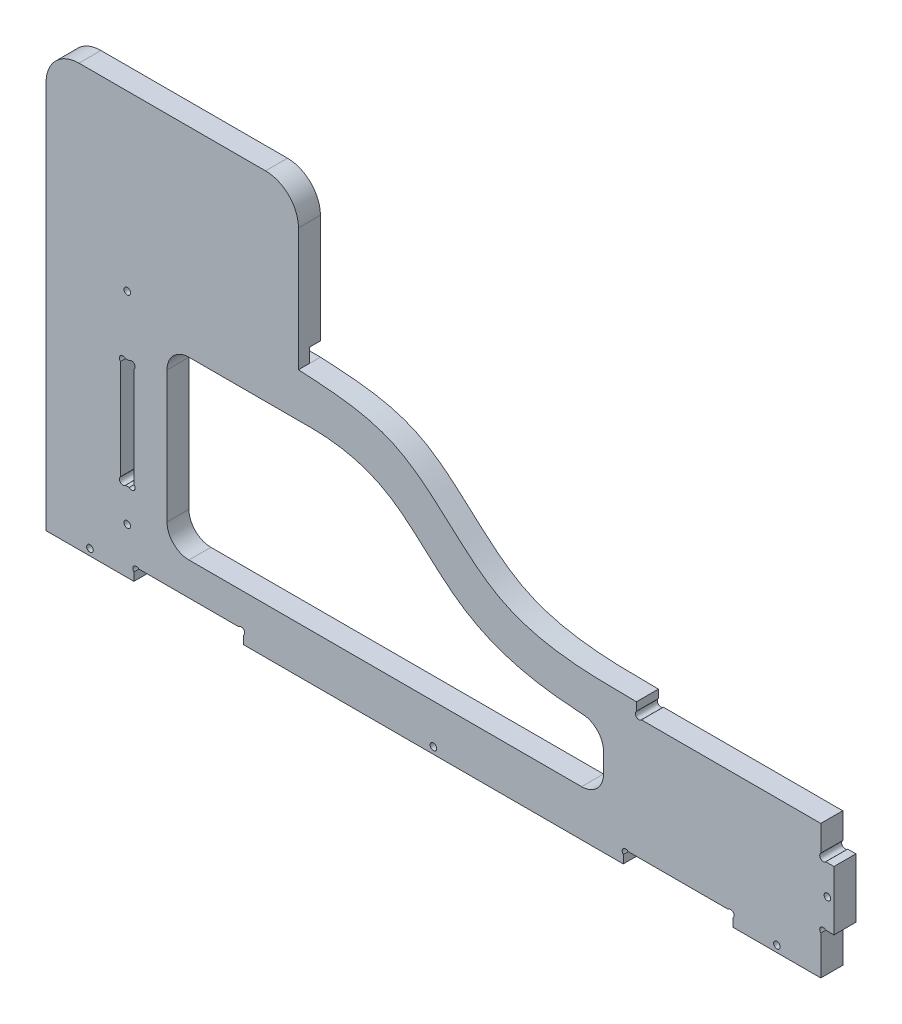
SolidWorks part; units mm, degrees
ref_plane "Face" through (0, 0, 0) normal (0, 0, 1) x (1, 0, 0)
ref_plane "Dessus" through (0, 0, 0) normal (0, 1, 0) x (1, 0, 0)
ref_plane "Droite" through (0, 0, 0) normal (1, 0, 0) x (0, 0, -1)
sketch "Esquisse1" plane through (0, 0, 0) normal (0, 0, 1) x (1, 0, 0)
  line L0 (294.7619, -27.7467) -> (210.7619, -27.7467)
  line L2 (-58.2381, 32.2533) -> (-58.2381, -88.7467)
  line L3 (-58.2381, -88.7467) -> (294.7619, -88.7467)
  line L4 (294.7619, -27.7467) -> (294.7619, -88.7467)
  line L5 (210.7619, -27.7467) -> (210.7619, -21.7467)
  line L6 (56.7619, 32.2533) -> (56.7619, 103.2533)
  line L7 (56.7619, 103.2533) -> (-58.2381, 103.2533)
  line L8 (-58.2381, 103.2533) -> (-58.2381, 32.2533)
  spline S0 degree 3 poles (210.7619, -21.7467) (188.0858, -21.6552) (145.0718, -21.4816) (108.2201, 29.4688) (72.4875, 31.4024) (56.7619, 32.2533) knots 0 0 0 0 0.384342 0.729054 1 1 1 1
  dimension "D7" = 71
  dimension "D1" = 353
  dimension "D2" = 121
  dimension "D3" = 154
  dimension "D4" = 61
  dimension "D5" = 84
  dimension "D6" = 6
  dimension "D8" = 71
extrude "Base-Extrusion" add sketch "Esquisse1" along normal blind 10
sketch "Esquisse2" plane through (0, 0, 0) normal (0, 0, -1) x (-1, 0, 0)
  line L0 (-56.7619, 32.2533) -> (-56.7619, 103.2533) construction
  line L1 (-56.7619, 38.6533) -> (58.2381, 38.6533)
  line L2 (-56.7619, 38.6533) -> (-56.7619, 32.2533)
  line L3 (-56.7619, 32.2533) -> (58.2381, 32.2533)
  line L4 (58.2381, 38.6533) -> (58.2381, 32.2533)
  line L5 (58.2381, 103.2533) -> (58.2381, -88.7467) construction
  line L6 (58.2381, -88.7467) -> (-294.7619, -88.7467) construction
  dimension "D1" = 121
  dimension "D2" = 6.4
extrude "Enlèv. mat.-Extru.1" cut sketch "Esquisse2" against normal blind 5
fillet "Congé1" radius 15 2 edges at (56.7619, 103.2533, 5) (-58.2381, 103.2533, 5)
sketch "Esquisse5" plane through (0, 0, 10) normal (0, 0, 1) x (1, 0, 0)
  line L0 (-58.2381, -88.7467) -> (294.7619, -88.7467) construction
  line L1 (254.7619, -88.7467) -> (204.7619, -88.7467)
  line L2 (254.7619, -88.7467) -> (254.7619, -82.7467)
  line L3 (254.7619, -82.7467) -> (204.7619, -82.7467)
  line L4 (204.7619, -88.7467) -> (204.7619, -82.7467)
  line L5 (294.7619, -88.7467) -> (294.7619, -27.7467) construction
  line L6 (-18.2381, -88.7467) -> (31.7619, -88.7467)
  line L7 (-18.2381, -88.7467) -> (-18.2381, -82.7467)
  line L8 (-18.2381, -82.7467) -> (31.7619, -82.7467)
  line L9 (31.7619, -88.7467) -> (31.7619, -82.7467)
  line L10 (-58.2381, 88.2533) -> (-58.2381, -88.7467) construction
  dimension "D1" = 40
  dimension "D2" = 50
  dimension "D3" = 6
  dimension "D4" = 6
  dimension "D5" = 50
  dimension "D6" = 40
extrude "Enlèv. mat.-Extru.3" cut sketch "Esquisse5" against normal up to vertex
sketch "Esquisse8" plane through (294.7619, 0, 0) normal (1, 0, 0) x (0, 0, -1)
  line L0 (-10, -88.7467) -> (-10, -27.7467) construction
  line L1 (-10, -41.7467) -> (0, -41.7467)
  line L2 (-10, -41.7467) -> (-10, -68.7467)
  line L3 (-10, -68.7467) -> (0, -68.7467)
  line L4 (0, -41.7467) -> (0, -68.7467)
  line L5 (0, -88.7467) -> (0, -27.7467) construction
  line L7 (-10, -88.7467) -> (0, -88.7467) construction
  line L8 (-10, -27.7467) -> (0, -27.7467) construction
  dimension "D1" = 14
  dimension "D2" = 20
extrude "Extrusion2" add sketch "Esquisse8" along normal blind 6
sketch "Esquisse9" plane through (0, 0, 10) normal (0, 0, 1) x (1, 0, 0)
  line L0 (-58.2381, 88.2533) -> (-58.2381, -88.7467) construction
  line L1 (-24.3381, -2.7467) -> (-18.1381, -2.7467)
  line L2 (-24.3381, -2.7467) -> (-24.3381, -52.7467)
  line L3 (-24.3381, -52.7467) -> (-18.1381, -52.7467)
  line L4 (-18.1381, -2.7467) -> (-18.1381, -52.7467)
  line L5 (-58.2381, -88.7467) -> (-18.2381, -88.7467) construction
  dimension "D1" = 6.2
  dimension "D2" = 33.9
  dimension "D3" = 36
  dimension "D4" = 50
extrude "Enlèv. mat.-Extru.5" cut sketch "Esquisse9" against normal up to vertex
sketch "Esquisse3" plane through (0, 0, 10) normal (0, 0, 1) x (1, 0, 0)
  line L0 (210.7619, -27.7467) -> (210.7619, -21.7467) construction
  line L1 (294.7619, -27.7467) -> (210.7619, -27.7467) construction
  line L2 (254.7619, -88.7467) -> (254.7619, -82.7467) construction
  line L3 (204.7619, -82.7467) -> (204.7619, -88.7467) construction
  line L4 (254.7619, -82.7467) -> (204.7619, -82.7467) construction
  line L5 (31.7619, -82.7467) -> (-18.2381, -82.7467) construction
  line L6 (-18.2381, -82.7467) -> (-18.2381, -88.7467) construction
  line L7 (31.7619, -88.7467) -> (31.7619, -82.7467) construction
  line L8 (-18.1381, -2.7467) -> (-24.3381, -2.7467) construction
  line L9 (-24.3381, -2.7467) -> (-24.3381, -52.7467) construction
  line L10 (294.7619, -41.7467) -> (294.7619, -27.7467) construction
  line L11 (300.7619, -41.7467) -> (294.7619, -41.7467) construction
  line L12 (300.7619, -68.7467) -> (294.7619, -68.7467) construction
  line L13 (294.7619, -88.7467) -> (294.7619, -68.7467) construction
  line L14 (-18.1381, -52.7467) -> (-18.1381, -2.7467) construction
  line L15 (-24.3381, -52.7467) -> (-18.1381, -52.7467) construction
  circle A0 centre (211.8619, -26.6467) radius 1.6
  circle A1 centre (253.6619, -83.8467) radius 1.6
  circle A2 centre (205.8619, -83.8467) radius 1.6
  circle A3 centre (30.6619, -83.8467) radius 1.6
  circle A4 centre (-17.1381, -83.8467) radius 1.6
  circle A5 centre (-19.2381, -3.8467) radius 1.6
  circle A6 centre (295.8619, -40.6467) radius 1.6
  circle A7 centre (295.8619, -69.8467) radius 1.6
  circle A8 centre (-23.2381, -3.8467) radius 1.6
  circle A9 centre (-19.2381, -51.6467) radius 1.6
  circle A10 centre (-23.2381, -51.6467) radius 1.6
  point P24 (31.7619, -85.7467)
  dimension "D1" = 1.1
  dimension "D3" = 1.1
  dimension "D7" = 1.1
  dimension "D11" = 1.1
  dimension "D13" = 1.1
  dimension "D15" = 1.1
  dimension "D19" = 1.1
  dimension "D2" = 1.1
  dimension "D4" = 1.1
  dimension "D5" = 1.1
  dimension "D6" = 1.1
  dimension "D8" = 1.1
  dimension "D9" = 1.1
  dimension "D10" = 1.1
  dimension "D12" = 1.1
  dimension "D14" = 1.1
  dimension "D16" = 1.1
  dimension "D17" = 1.1
  dimension "D18" = 1.1
  dimension "D20" = 1.1
  dimension "D21" = 1.1
  dimension "D22" = 1.1
extrude "Enlèv. mat.-Extru.2" cut sketch "Esquisse3" against normal up to vertex
sketch "Esquisse6" plane through (0, 0, 10) normal (0, 0, 1) x (1, 0, 0)
  line L0 (294.7619, -88.7467) -> (294.7619, -71.0086) construction
  line L1 (254.7619, -88.7467) -> (294.7619, -88.7467) construction
  line L2 (31.7619, -88.7467) -> (204.7619, -88.7467) construction
  line L3 (-58.2381, 88.2533) -> (-58.2381, -88.7467) construction
  line L4 (-58.2381, -88.7467) -> (-18.2381, -88.7467) construction
  line L5 (31.7619, -88.7467) -> (31.7619, -85.0086) construction
  line L6 (-22.0762, -52.7467) -> (-20.4, -52.7467) construction
  line L7 (300.7619, -41.7467) -> (297.0238, -41.7467) construction
  line L8 (-20.4, -2.7467) -> (-22.0762, -2.7467) construction
  line L9 (300.7619, -41.7467) -> (300.7619, -68.7467) construction
  circle A0 centre (-38.2381, -85.7467) radius 1.5
  circle A1 centre (118.2619, -85.7467) radius 1.5
  circle A2 centre (274.7619, -85.7467) radius 1.5
  circle A3 centre (297.7619, -55.2467) radius 1.5
  circle A4 centre (-21.2381, -67.7467) radius 1.5
  circle A5 centre (-21.2381, 24.2533) radius 1.5
  dimension "D1" = 20
  dimension "D7" = 13.5
  dimension "D9" = 15
  dimension "D2" = 3
  dimension "D3" = 3
  dimension "D4" = 20
  dimension "D5" = 3
  dimension "D6" = 86.5
  dimension "D8" = 3
  dimension "D10" = 27
  dimension "D11" = 37
  dimension "D12" = 37
extrude "Enlèv. mat.-Extru.4" cut sketch "Esquisse6" against normal up to vertex
sketch "Esquisse10" plane through (0, 0, 0) normal (0, 0, -1) x (-1, 0, 0)
  line L0 (-41.7619, 103.2533) -> (43.2381, 103.2533) construction
  line L1 (-56.7619, 38.6533) -> (-56.7619, 88.2533) construction
  circle A0 centre (-22.2619, 93.2533) radius 1
  circle A1 centre (23.7381, 93.2533) radius 1
  circle A2 centre (-22.2619, 71.2533) radius 1
  circle A3 centre (23.7381, 71.2533) radius 1
  dimension "D8" = 34.5
  dimension "D1" = 10
  dimension "D2" = 10
  dimension "D3" = 46
  dimension "D4" = 46
  dimension "D5" = 22
  dimension "D6" = 22
  dimension "D7" = 34.5
extrude "Enlèv. mat.-Extru.6" cut sketch "Esquisse10" against normal blind 5
sketch "Esquisse11" plane through (0, 0, 10) normal (0, 0, 1) x (1, 0, 0)
  line L0 (-18.1381, -50.4848) -> (-18.1381, -5.0086) construction
  line L1 (-3.1381, -67.7467) -> (195.7619, -67.7467)
  line L2 (-3.1381, -67.7467) -> (-3.1381, 12.2533)
  line L3 (-3.1381, 12.2533) -> (57.4355, 12.2533)
  line L4 (195.7619, -67.7467) -> (195.7619, -39.303)
  line L5 (29.5, -82.7467) -> (-15.9762, -82.7467) construction
  line L6 (210.7619, -25.4848) -> (210.7619, -21.7467) construction
  spline S0 degree 3 poles (57.4355, 12.2533) (70.0322, 12.5021) (95.7734, 11.1891) (135.6419, -33.7595) (169.1165, -38.5764) (195.7619, -39.303) knots 0 0 0 0 0.349213 0.582983 1 1 1 1
  dimension "D1" = 15
  dimension "D2" = 15
  dimension "D3" = 20
  dimension "D4" = 15
extrude "Enlèv. mat.-Extru.7" cut sketch "Esquisse11" against normal through all
fillet "Congé2" radius 10 4 edges at (-3.1381, 12.2533, 5) (-3.1381, -67.7467, 5) (195.7619, -67.7467, 5) (195.7619, -39.303, 5)
